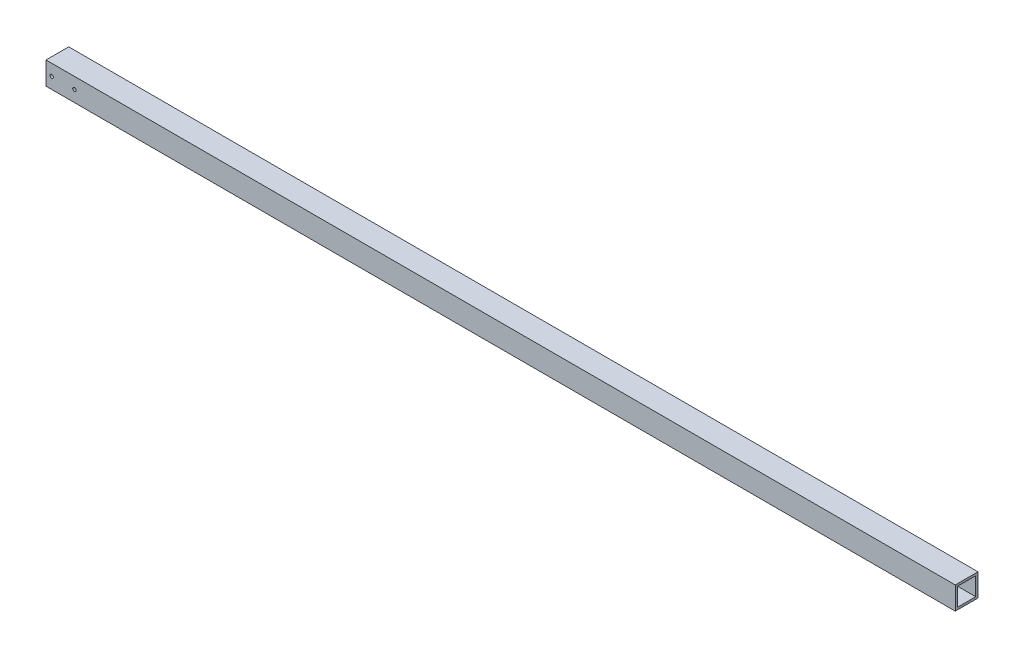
SolidWorks part; units mm, degrees
ref_plane "正面" through (0, 0, 0) normal (0, 0, 1) x (1, 0, 0)
ref_plane "平面" through (0, 0, 0) normal (0, 1, 0) x (1, 0, 0)
ref_plane "右側面" through (0, 0, 0) normal (1, 0, 0) x (0, 0, -1)
sketch "ｽｹｯﾁ1" plane through (0, 0, 0) normal (1, 0, 0) x (0, 0, -1)
  line L1 (-8, -8) -> (8, -8)
  line L2 (-8, -8) -> (-8, 8)
  line L3 (-8, 8) -> (8, 8)
  line L4 (8, -8) -> (8, 8)
  line L5 (-8, -8) -> (8, 8) construction
  line L6 (-8, 8) -> (8, -8) construction
  line L7 (-10, -10) -> (10, -10)
  line L8 (-10, -10) -> (-10, 10)
  line L9 (-10, 10) -> (10, 10)
  line L10 (10, -10) -> (10, 10)
  line L11 (-10, -10) -> (10, 10) construction
  line L12 (-10, 10) -> (10, -10) construction
  point P0 (0, 0)
  point P6 (0, 0)
  dimension "D1" = 16
  dimension "D2" = 16
  dimension "D3" = 20
extrude "押し出し1" add sketch "ｽｹｯﾁ1" along normal blind 800
sketch "ｽｹｯﾁ2" plane through (0, 0, 10) normal (0, 0, 1) x (1, 0, 0)
  line L0 (0, 0) -> (5, 0) construction
  line L1 (0, 10) -> (0, -10) construction
  circle A0 centre (5, 0) radius 1.5
  dimension "D2" = 3
  dimension "D1" = 5
extrude "押し出し2" cut sketch "ｽｹｯﾁ2" against normal through all
sketch "ｽｹｯﾁ3" plane through (0, 0, 10) normal (0, 0, 1) x (1, 0, 0)
  line L0 (0, 0) -> (25, 0) construction
  line L1 (0, 10) -> (0, -10) construction
  circle A0 centre (25, 0) radius 1.5
  dimension "D2" = 3
  dimension "D1" = 25
extrude "押し出し3" cut sketch "ｽｹｯﾁ3" against normal through all
